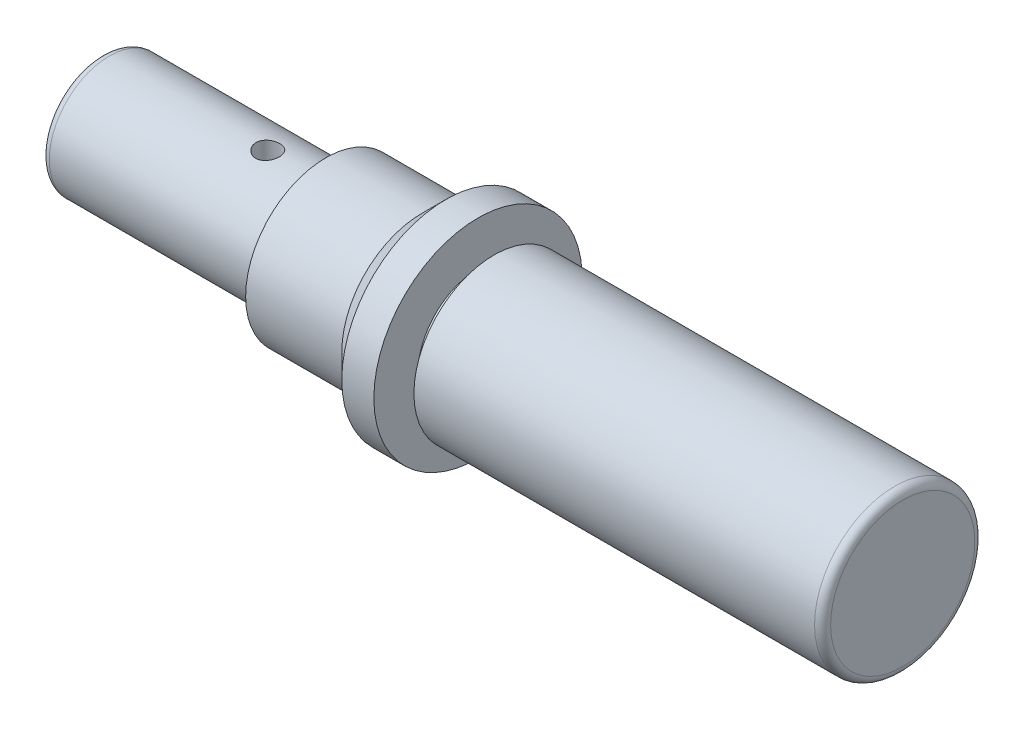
SolidWorks part; units mm, degrees
ref_plane "Front Plane" through (0, 0, 0) normal (0, 0, 1) x (1, 0, 0)
ref_plane "Top Plane" through (0, 0, 0) normal (0, 1, 0) x (1, 0, 0)
ref_plane "Right Plane" through (0, 0, 0) normal (1, 0, 0) x (0, 0, -1)
sketch "Sketch1" plane through (0, 0, 0) normal (0, 0, 1) x (1, 0, 0)
  line L0 (-61.6998, 9.8978) -> (-61.6998, 17.3978)
  line L1 (-61.6998, 17.3978) -> (-33.6998, 17.3978)
  line L2 (-33.6998, 17.3978) -> (-33.6998, 19.8978)
  line L3 (-33.6998, 19.8978) -> (-21.6998, 19.8978)
  line L4 (-21.6998, 19.8978) -> (-18.6998, 22.8978)
  line L5 (-18.6998, 22.8978) -> (-14.6998, 22.8978)
  line L6 (-14.6998, 22.8978) -> (-14.6998, 17.3978)
  line L7 (-14.6998, 17.3978) -> (-12.6998, 17.3978)
  line L8 (-12.6998, 17.3978) -> (-12.6998, 19.8978)
  line L9 (-12.6998, 19.8978) -> (38.3002, 19.8978)
  line L10 (38.3002, 19.8978) -> (38.3002, 9.8978)
  line L11 (-61.6998, 9.8978) -> (41.8177, 9.8978) construction
  line L12 (-61.6998, 9.8978) -> (38.3002, 9.8978)
  dimension "D1" = 7.5
  dimension "D2" = 28
  dimension "D3" = 10
  dimension "D4" = 135
  dimension "D5" = 13
  dimension "D6" = 7
  dimension "D7" = 2
  dimension "D8" = 10
  dimension "D9" = 53
  dimension "D10" = 12
  dimension "D11" = 7.5
revolve "Revolve1" add sketch "Sketch1" angle 360 about L11
fillet "Fillet1" radius 1 2 edges at (38.3002, 9.8978, 10) (-61.6998, 9.8978, 7.5)
hole_wizard "Ø1.0mm Dowel Hole1" positions "3DSketch5" profile "Sketch7" hole size "Ø1.0" standard "ISO"
sketch3d "3DSketch5"
  line L0 (-40.6998, 17.3941, 0.2355) -> (-33.6998, 17.3941, 0.2355) construction
  circle A1 centre (-33.6998, 9.8978, 0) radius 7.5 construction
  point P0 (-40.6998, 17.3941, 0.2355)
  point P9 (-41.1998, 9.8978, 0)
  dimension "D1" = 7
sketch "Sketch7" plane through (-40.6998, 17.3941, 0.2355) normal (1, 0, 0) x (0, -0.0314, 0.9995)
  line L0 (0, 0) -> (0, 20.9018)
  line L1 (0, 20.9018) -> (1.5, 20.9018)
  line L2 (1.5, 20.9018) -> (1.5, 0)
  line L5 (1.5, 0) -> (0, 0)
  line L11 (0, -6.35) -> (0, 107.95) construction
  dimension "Thru Hole Dia." = 3
  dimension "Thru Hole Depth" = 20.9018
